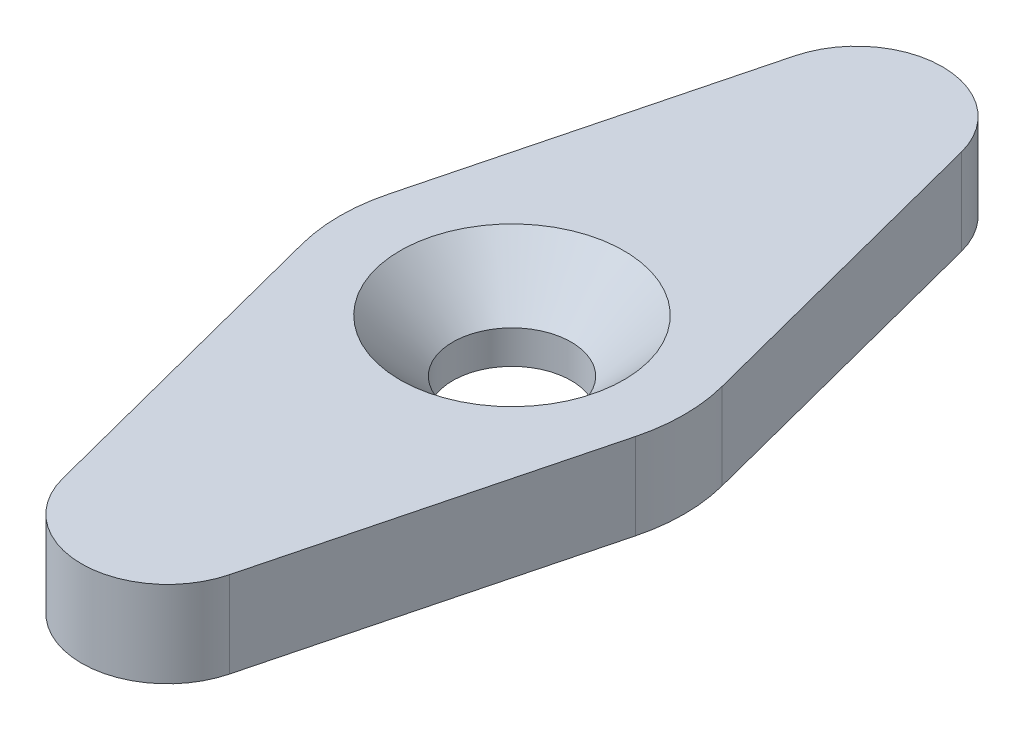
SolidWorks part; units mm, degrees
ref_plane "Front Plane" through (0, 0, 0) normal (0, 0, 1) x (1, 0, 0)
ref_plane "Top Plane" through (0, 0, 0) normal (0, 1, 0) x (1, 0, 0)
ref_plane "Right Plane" through (0, 0, 0) normal (1, 0, 0) x (0, 0, -1)
sketch "Sketch1" plane through (0, 0, 0) normal (0, 1, 0) x (1, 0, 0)
  line L0 (0, 16) -> (0, -16) construction
  line L1 (3.873, -17) -> (7.746, -2)
  line L2 (3.873, 17) -> (7.746, 2)
  line L3 (-3.873, -17) -> (-7.746, -2)
  line L4 (-3.873, 17) -> (-7.746, 2)
  arc A0 (7.746, -2) -> (7.746, 2) centre (0, 0) ccw
  arc A1 (3.873, 17) -> (-3.873, 17) centre (0, 16) ccw
  arc A2 (-3.873, -17) -> (3.873, -17) centre (0, -16) ccw
  arc A3 (-7.746, 2) -> (-7.746, -2) centre (0, 0) ccw
  dimension "D1" = 16
  dimension "D2" = 16
  dimension "D3" = 8
  dimension "D4" = 4
  dimension "D5" = 4
extrude "Extrude1" add sketch "Sketch1" along normal blind 4
sketch "Sketch2" plane through (0, 4, 0) normal (0, 1, 0) x (1, 0, 0)
  point P0 (0, 0)
hole_wizard "CSK for M5 Countersunk Flat Head Screw1" positions "3DSketch1" profile "Sketch3" countersink size "M5" standard "ISO"
sketch3d "3DSketch1"
  point P0 (0, 4, 0)
sketch "Sketch3" plane through (0, 4, 0) normal (1, 0, 0) x (0, 0, 1)
  line L0 (0, 0) -> (0, 4)
  line L1 (0, 4) -> (2.75, 4)
  line L2 (2.75, 4) -> (2.75, 2.45)
  line L3 (2.75, 2.45) -> (5.2, 0)
  line L5 (5.2, 0) -> (0, 0)
  line L6 (-2.75, 2.45) -> (-5.2, 0) construction
  line L11 (0, -6.35) -> (0, 107.95) construction
  dimension "Thru Hole Dia." = 5.5
  dimension "Thru Hole Depth" = 4
  dimension "Near C'Sink Dia." = 10.4
  dimension "Near C'Sink Angle" = 90
